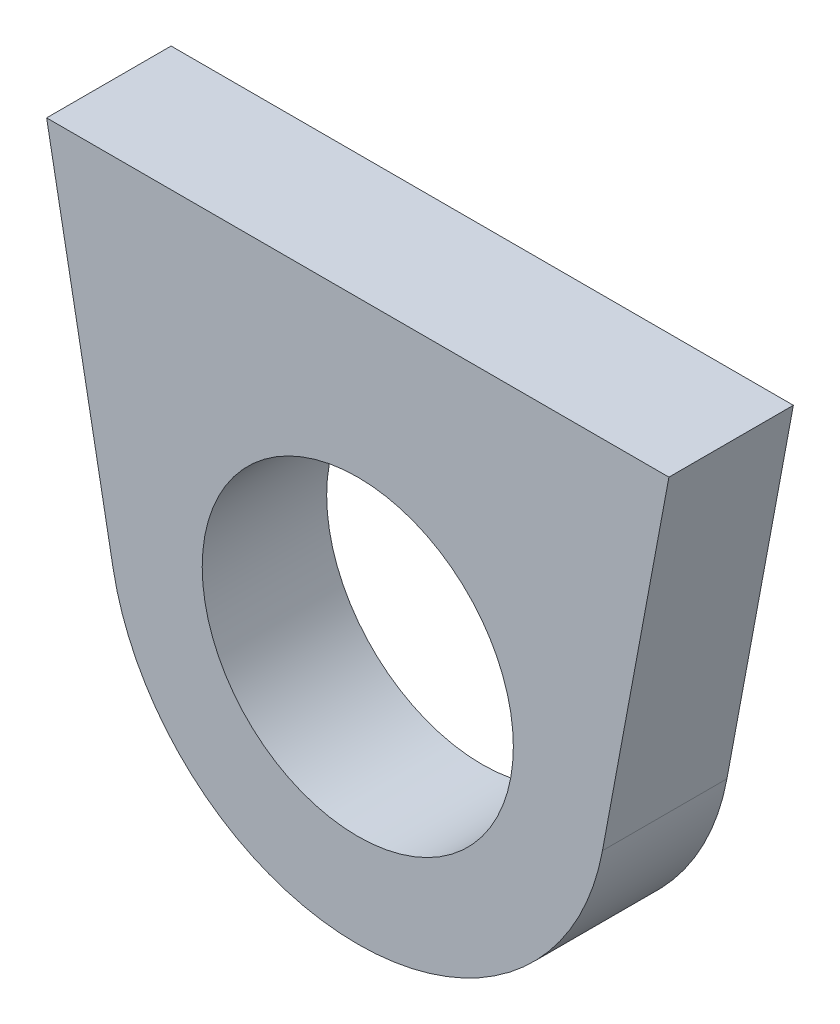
SolidWorks part; units mm, degrees
ref_plane "Alzado" through (0, 0, 0) normal (0, 0, 1) x (1, 0, 0)
ref_plane "Planta" through (0, 0, 0) normal (0, 1, 0) x (1, 0, 0)
ref_plane "Vista lateral" through (0, 0, 0) normal (1, 0, 0) x (0, 0, -1)
sketch "Croquis1" plane through (0, 0, 0) normal (0, 0, 1) x (1, 0, 0)
  line L0 (-78.6476, -14.6476) -> (-100, 100)
  line L1 (-100, 100) -> (100, 100)
  line L2 (100, 100) -> (78.6476, -14.6476)
  line L3 (0, 0) -> (0, 100) construction
  circle A0 centre (0, 0) radius 50
  arc A1 (-78.6476, -14.6476) -> (78.6476, -14.6476) centre (0, 0) ccw
  arc A2 (0, 80) -> (-78.6476, -14.6476) centre (0, 0) ccw construction
  arc A3 (78.6476, -14.6476) -> (0, 80) centre (0, 0) ccw construction
  dimension "D2" = 100
  dimension "D3" = 80
  dimension "D1" = 100
  dimension "D4" = 200
extrude "Saliente-Extruir1" add sketch "Croquis1" along normal blind 40
